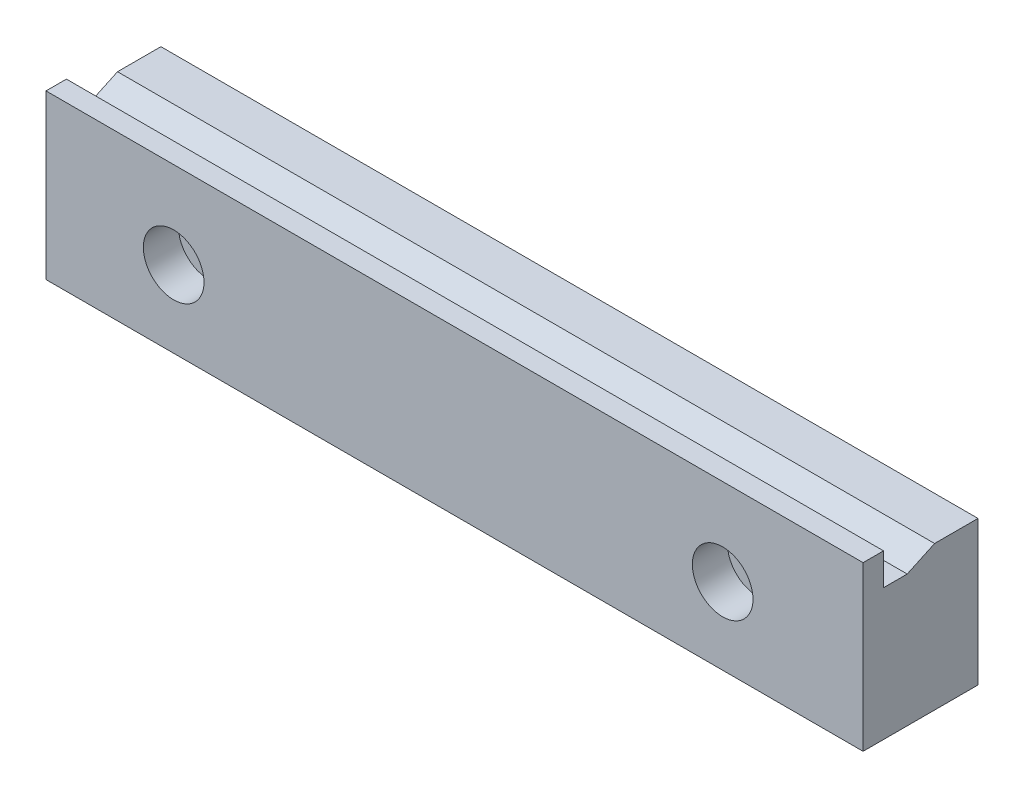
SolidWorks part; units mm, degrees
ref_plane "前视基准面" through (0, 0, 0) normal (0, 0, 1) x (1, 0, 0)
ref_plane "上视基准面" through (0, 0, 0) normal (0, 1, 0) x (1, 0, 0)
ref_plane "右视基准面" through (0, 0, 0) normal (1, 0, 0) x (0, 0, -1)
sketch "草图1" plane through (0, 0, 0) normal (0, 0, 1) x (1, 0, 0)
  line L0 (0, 0) -> (128, 0)
  line L1 (0, 0) -> (0, 25.6)
  line L2 (128, 0) -> (128, 25.6)
  line L3 (0, 25.6) -> (128, 25.6)
  circle A0 centre (106, 12) radius 2.75
  circle A1 centre (20, 12) radius 2.75
extrude "凸台-拉伸1" add sketch "草图1" along normal blind 18
sketch "草图2" plane through (0, 0, 18) normal (0, 0, 1) x (1, 0, 0)
  circle A0 centre (106, 12) radius 4.75
  circle A1 centre (20, 12) radius 4.75
extrude "切除-拉伸1" cut sketch "草图2" against normal blind 5.5
sketch "草图3" plane through (128, 0, 0) normal (1, 0, 0) x (0, 0, -1)
  line L0 (-18, 0) -> (0, 0)
  line L1 (-18, 25.6) -> (-14.8, 25.6)
  line L2 (-6.8, 22.6) -> (0, 22.6)
  line L3 (0, 0) -> (0, 22.6)
  line L4 (-14.8, 20.6) -> (-14.8, 25.6)
  line L5 (-18, 0) -> (-18, 25.6)
  line L6 (-11.089, 20.6) -> (-6.8, 22.6)
  line L7 (-14.8, 20.6) -> (-11.089, 20.6)
extrude "切除-拉伸2" cut sketch "草图3" against normal through all flip side to cut
